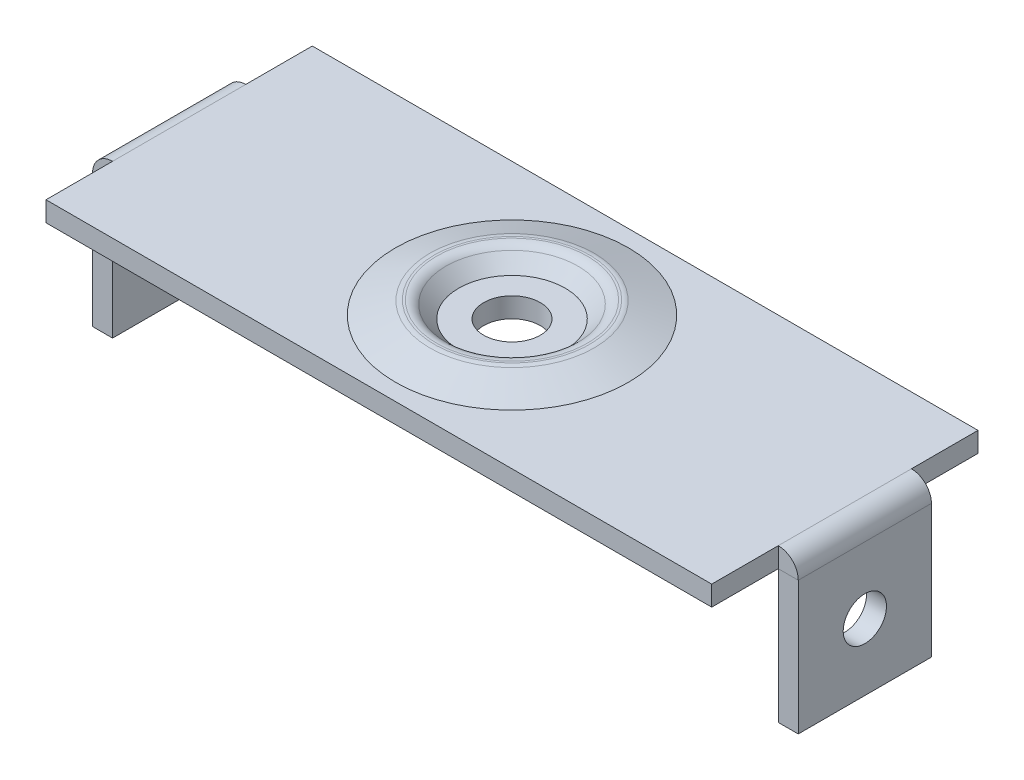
SolidWorks part; units mm, degrees
ref_plane "Plan1" through (0, 0, 0) normal (0, 0, 1) x (1, 0, 0)
ref_plane "Plan2" through (0, 0, 0) normal (0, 1, 0) x (1, 0, 0)
ref_plane "Plan3" through (0, 0, 0) normal (1, 0, 0) x (0, 0, -1)
sketch "Esquisse1" plane through (0, 0, 0) normal (0, 0, 1) x (1, 0, 0)
  line L0 (50, 0) -> (-50, 0)
  line L1 (0, 50) -> (0, -40) construction
  point P6 (0, 0)
  dimension "D1" = 100
extrude "Base-Extru.-Mince" add sketch "Esquisse1" along normal mid plane 40 thin
sketch "Esquisse3" plane through (0, 1.5, 0) normal (0, 1, 0) x (-1, 0, 0)
  line L0 (50, 10) -> (50, -10)
  line L1 (50, 20) -> (50, -20) construction
extrude "Boss.-Extru.-Mince2" add sketch "Esquisse3" against normal blind 23 thin
mirror "Symétrie1" about plane through (0, 0, 0) normal (1, 0, 0)
sketch "Esquisse4" plane through (53, 0, 0) normal (1, 0, 0) x (0, 0, -1)
  line L0 (-10, -21.5) -> (10, -21.5) construction
  circle A0 centre (0, -11.5) radius 3.25
  dimension "D1" = 6.5
  dimension "D2" = 10
extrude "Enlèv. mat.-Extru.1" cut sketch "Esquisse4" against normal through all
sketch "Esquisse5" plane through (0, 1.5, 0) normal (0, 1, 0) x (-1, 0, 0)
  circle A0 centre (0, 0) radius 17.5
  dimension "D1" = 35
extrude "Boss.-Extru.1" add sketch "Esquisse5" along normal blind 2 draft 70
sketch "Esquisse6" plane through (0, -1.5, 0) normal (0, -1, 0) x (1, 0, 0)
  circle A0 centre (0, 0) radius 17.5
  dimension "D1" = 35
extrude "Enlèv. mat.-Extru.2" cut sketch "Esquisse6" against normal blind 2 draft 70
sketch "Esquisse7" plane through (0, 0.5, 0) normal (0, -1, 0) x (1, 0, 0)
  circle A0 centre (0, 0) radius 10.5
  dimension "D1" = 21
extrude "Boss.-Extru.3" add sketch "Esquisse7" along normal blind 2.5 draft 45
sketch "Esquisse8" plane through (0, 3.5, 0) normal (0, 1, 0) x (-1, 0, 0)
  circle A0 centre (0, 0) radius 10.5
  dimension "D1" = 21
extrude "Enlèv. mat.-Extru.3" cut sketch "Esquisse8" against normal blind 2.5 draft 45
fillet "Congé2" radius 2
fillet "Congé3" radius 6
sketch "Esquisse13" plane through (0, 1, 0) normal (0, 1, 0) x (-1, 0, 0)
  circle A0 centre (0, 0) radius 4.25
  dimension "D1" = 8.5
extrude "Enlèv. mat.-Extru.4" cut sketch "Esquisse13" against normal through all
sheet metal parameters "Tôlerie 1" parameters "D1"=0
bend "Pli dans angle2" bend angle 90 parameters "D1"=0, "D5"=1
flatten bends "Dépliage 1" parameters "D1"=0
sketch "Esquisse-Angle1" plane through (0, 1.5, 0) normal (0, 1, 0) x (-1, 0, 0)
  line L0 (51.1781, 10) -> (51.1781, -10) construction
  line L1 (-51.1781, -10) -> (-51.1781, 10) construction
bend "Pli dans angle1" bend angle 90 parameters "D1"=0, "D5"=2
process bends "Pliage 1" parameters "D1"=0
sketch "Esquisse-Plate1" plane through (0, 1.5, 0) normal (0, 1, 0) x (-1, 0, 0)
